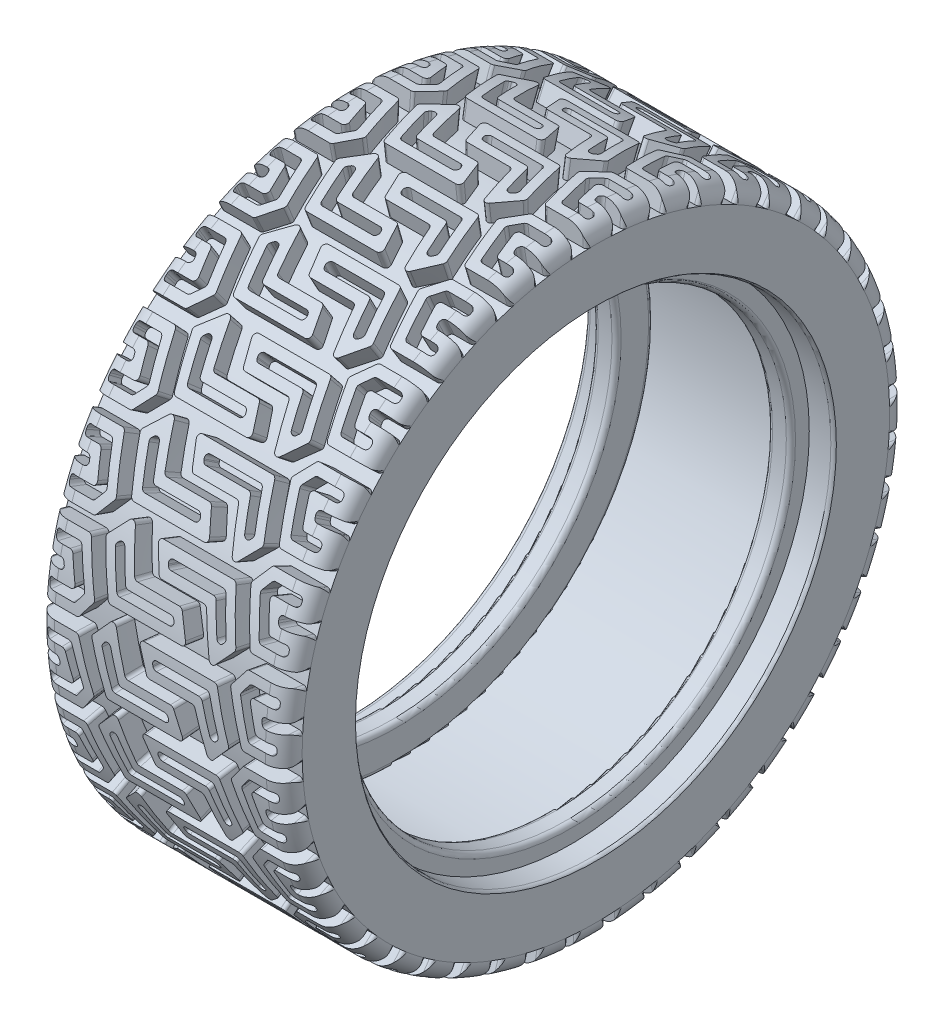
SolidWorks part; units mm, degrees
ref_plane "前视基准面" through (0, 0, 0) normal (0, 0, 1) x (1, 0, 0)
ref_plane "上视基准面" through (0, 0, 0) normal (0, 1, 0) x (1, 0, 0)
ref_plane "右视基准面" through (0, 0, 0) normal (1, 0, 0) x (0, 0, -1)
other "Configuration Table"
sketch "草图3" plane through (0, 0, 0) normal (0, 1, 0) x (1, 0, 0)
  line L0 (0, 0) -> (0, 32) construction
  line L1 (13.6, 32) -> (-13.6, 32)
  line L2 (-13.6, 32) -> (-13.6, 26.5)
  line L3 (-13.1, 26) -> (-10.75, 26)
  line L4 (-10.75, 26) -> (-10.75, 24.5)
  line L5 (-10.25, 24) -> (-8.75, 24)
  line L6 (10.75, 26) -> (10.75, 24.5)
  line L7 (13.1, 26) -> (10.75, 26)
  line L8 (13.6, 32) -> (13.6, 26.5)
  line L9 (-8.25, 24.5) -> (-8.25, 27.5)
  line L10 (-8.75, 28) -> (-11.1, 28)
  line L11 (-11.6, 28.5) -> (-11.6, 29.5)
  line L12 (-11.1, 30) -> (11.1, 30)
  line L13 (11.6, 28.5) -> (11.6, 29.5)
  line L14 (8.25, 24.5) -> (8.25, 27.5)
  line L15 (8.75, 28) -> (11.1, 28)
  line L16 (8.75, 24) -> (10.25, 24)
  line L17 (0, 0) -> (-29.1572, 0) construction
  arc A0 (13.1, 26) -> (13.6, 26.5) centre (13.1, 26.5) ccw
  arc A1 (10.75, 24.5) -> (10.25, 24) centre (10.25, 24.5) cw
  arc A2 (8.25, 24.5) -> (8.75, 24) centre (8.75, 24.5) ccw
  arc A3 (8.25, 27.5) -> (8.75, 28) centre (8.75, 27.5) cw
  arc A4 (11.6, 28.5) -> (11.1, 28) centre (11.1, 28.5) cw
  arc A5 (11.6, 29.5) -> (11.1, 30) centre (11.1, 29.5) ccw
  arc A6 (-11.6, 29.5) -> (-11.1, 30) centre (-11.1, 29.5) cw
  arc A7 (-11.1, 28) -> (-11.6, 28.5) centre (-11.1, 28.5) cw
  arc A8 (-8.25, 27.5) -> (-8.75, 28) centre (-8.75, 27.5) ccw
  arc A9 (-8.25, 24.5) -> (-8.75, 24) centre (-8.75, 24.5) cw
  arc A10 (-10.75, 24.5) -> (-10.25, 24) centre (-10.25, 24.5) ccw
  arc A11 (-13.6, 26.5) -> (-13.1, 26) centre (-13.1, 26.5) ccw
  point P9 (0, 24)
  point P21 (0, 30)
  point P24 (13.6, 26)
  point P27 (10.75, 24)
  point P30 (8.25, 24)
  point P33 (8.25, 28)
  point P36 (11.6, 28)
  point P39 (11.6, 30)
  point P42 (-11.6, 30)
  point P45 (-11.6, 28)
  point P48 (-8.25, 28)
  point P51 (-8.25, 24)
  point P54 (-10.75, 24)
  point P57 (-13.6, 26)
  dimension "D10" = 0.5
  dimension "D1" = 27.2
  dimension "D2" = 24
  dimension "D3" = 32
  dimension "D4" = 26
  dimension "D5" = 21.5
  dimension "D6" = 2
  dimension "D7" = 2.5
  dimension "D8" = 2
  dimension "D9" = 2
revolve "旋转1" add sketch "草图3" angle 360 about L17
sketch "草图4" plane through (0, 0, 0) normal (0, 0, 1) x (1, 0, 0)
  line L0 (0, 0) -> (-20.571, 0) construction
  line L1 (-3.75, -0.6) -> (1.4, -0.6)
  line L2 (1.4, -0.6) -> (2.5, -3.5)
  line L3 (2.5, -3.5) -> (-6, -3.5)
  line L4 (-6, -3.5) -> (-7.5, 1.5)
  line L5 (-7.5, 1.5) -> (-5.13, 4)
  line L6 (-5.13, 4) -> (-3.75, -0.6)
  line L7 (-8.916, 1) -> (-7.416, -4)
  line L8 (-7.416, -4) -> (-9, -6)
  line L9 (-9, -6) -> (-13.5, -6)
  line L11 (-13.5, -6) -> (-13.5, -3)
  line L12 (-13.5, -3) -> (-10.8481, -3)
  line L13 (-10.8481, -3) -> (-11.1481, -2)
  line L14 (-11.1481, -2) -> (-13.5, -2)
  line L15 (-13.5, -2) -> (-13.5, 1)
  line L16 (-13.5, 1) -> (-8.916, 1)
  line L17 (-9.6601, 0) -> (-8.5237, -3.7879)
  line L18 (-8.5237, -3.7879) -> (-9.4837, -5)
  line L19 (-9.4837, -5) -> (-12.5, -5)
  line L20 (-12.5, -5) -> (-12.5, -4)
  line L21 (-12.5, -4) -> (-9.5041, -4)
  line L22 (-9.5041, -4) -> (-10.4041, -1)
  line L23 (-10.4041, -1) -> (-12.5, -1)
  line L24 (-12.5, -1) -> (-12.5, 0)
  line L25 (-12.5, 0) -> (-9.6601, 0)
  line L26 (-4.494, -1.6) -> (0.7098, -1.6)
  line L27 (0.7098, -1.6) -> (1.0512, -2.5)
  line L28 (1.0512, -2.5) -> (-5.256, -2.5)
  line L29 (-5.256, -2.5) -> (-6.3757, 1.2324)
  line L30 (-6.3757, 1.2324) -> (-5.5918, 2.0593)
  line L31 (-5.5918, 2.0593) -> (-4.494, -1.6)
  line L32 (13.5, -1) -> (8.916, -1)
  line L33 (8.916, -1) -> (7.416, 4)
  line L34 (7.416, 4) -> (9, 6)
  line L35 (9, 6) -> (13.5, 6)
  line L36 (13.5, 6) -> (13.5, 3)
  line L37 (13.5, 3) -> (10.8481, 3)
  line L38 (10.8481, 3) -> (11.1481, 2)
  line L39 (11.1481, 2) -> (13.5, 2)
  line L40 (13.5, 2) -> (13.5, -1)
  line L41 (9.6601, 0) -> (8.5237, 3.7879)
  line L42 (8.5237, 3.7879) -> (9.4837, 5)
  line L43 (9.4837, 5) -> (12.5, 5)
  line L44 (12.5, 5) -> (12.5, 4)
  line L45 (12.5, 4) -> (9.5041, 4)
  line L46 (9.5041, 4) -> (10.4041, 1)
  line L47 (10.4041, 1) -> (12.5, 1)
  line L48 (12.5, 1) -> (12.5, 0)
  line L49 (12.5, 0) -> (9.6601, 0)
  line L50 (5.13, -4) -> (3.75, 0.6)
  line L51 (3.75, 0.6) -> (-1.4, 0.6)
  line L52 (-1.4, 0.6) -> (-2.5, 3.5)
  line L53 (-2.5, 3.5) -> (6, 3.5)
  line L54 (6, 3.5) -> (7.5, -1.5)
  line L55 (7.5, -1.5) -> (5.13, -4)
  line L56 (4.494, 1.6) -> (-0.7098, 1.6)
  line L57 (-0.7098, 1.6) -> (-1.0512, 2.5)
  line L58 (-1.0512, 2.5) -> (5.256, 2.5)
  line L59 (5.256, 2.5) -> (6.3757, -1.2324)
  line L60 (6.3757, -1.2324) -> (5.5918, -2.0593)
  line L61 (5.5918, -2.0593) -> (4.494, 1.6)
  line L62 (-13.6, 32) -> (-13.6, -32) construction
  point P35 (0, 0)
  point P36 (-8.0407, -3.7654)
  point P37 (0, 0)
  point P68 (0, 0)
  point P69 (-10.468, -4)
  point P70 (0, 0)
  point P71 (0, 0)
  point P72 (0, 0)
  dimension "D4" = 1.2
  dimension "D5" = 7
  dimension "D6" = 5
  dimension "D7" = 2.8
  dimension "D8" = 12
  dimension "D9" = 7.5
  dimension "D10" = 15
  dimension "D11" = 3
  dimension "D12" = 8
  dimension "D13" = 1.5
  dimension "D14" = 3
  dimension "D15" = 7
  dimension "D16" = 1
  dimension "D17" = 5
  dimension "D18" = 4.5
  dimension "D19" = 1
  dimension "D20" = 0.1
  dimension "D1" = 1
  dimension "D2" = 1
  dimension "D3" = 2
sketch "草图5" plane through (0, 0, 0) normal (0, 0, 1) x (1, 0, 0)
  line L6 (1.4, -0.6) -> (-3.75, -0.6)
  line L7 (2.5, -3.5) -> (1.4, -0.6)
  line L8 (-6, -3.5) -> (2.5, -3.5)
  line L9 (-7.5, 1.5) -> (-6, -3.5)
  line L10 (-5.13, 4) -> (-7.5, 1.5)
  line L11 (-3.75, -0.6) -> (-5.13, 4)
  line L12 (1.1239, -0.6) -> (-3.4524, -0.6)
  line L13 (2.2945, -2.9581) -> (1.4979, -0.8581)
  line L14 (-5.7024, -3.5) -> (1.9205, -3.5)
  line L15 (-7.4334, 1.278) -> (-6.0855, -3.2149)
  line L16 (-5.605, 3.4989) -> (-7.3406, 1.6682)
  line L17 (-3.8355, -0.3149) -> (-4.9316, 3.3387)
  line L18 (3.75, 0.6) -> (5.13, -4)
  line L19 (-1.4, 0.6) -> (3.75, 0.6)
  line L20 (-2.5, 3.5) -> (-1.4, 0.6)
  line L21 (-9.4837, -5) -> (-8.5237, -3.7879)
  line L22 (-12.5, -5) -> (-9.4837, -5)
  line L23 (-12.5, -4) -> (-12.5, -5)
  line L24 (-9.5041, -4) -> (-12.5, -4)
  line L25 (-10.4041, -1) -> (-9.5041, -4)
  line L26 (-12.5, -1) -> (-10.4041, -1)
  line L27 (-12.5, 0) -> (-12.5, -1)
  line L28 (-9.6601, 0) -> (-12.5, 0)
  line L29 (-8.5237, -3.7879) -> (-9.6601, 0)
  line L30 (-9.3635, -4.8483) -> (-8.6532, -3.9514)
  line L31 (-12.1, -5) -> (-9.6771, -5)
  line L32 (-12.5, -4.4) -> (-12.5, -4.6)
  line L33 (-10.0417, -4) -> (-12.1, -4)
  line L34 (-10.3186, -1.2851) -> (-9.6586, -3.4851)
  line L35 (-12.1, -1) -> (-10.7017, -1)
  line L36 (-12.5, -0.4) -> (-12.5, -0.6)
  line L37 (-9.9577, 0) -> (-12.1, 0)
  line L38 (-8.5836, -3.5881) -> (-9.5746, -0.2851)
  line L39 (-10.8481, -3) -> (-13.5, -3)
  line L40 (-11.1481, -2) -> (-10.8481, -3)
  line L41 (-13.5, -2) -> (-11.1481, -2)
  line L42 (-13.5, 1) -> (-13.5, -2)
  line L43 (-8.916, 1) -> (-13.5, 1)
  line L44 (-7.416, -4) -> (-8.916, 1)
  line L45 (-9, -6) -> (-7.416, -4)
  line L46 (-13.5, -6) -> (-9, -6)
  line L47 (-13.5, -3) -> (-13.5, -6)
  line L48 (-11.3858, -3) -> (-13.1, -3)
  line L49 (-11.0626, -2.2851) -> (-11.0026, -2.4851)
  line L50 (-13.1, -2) -> (-11.4458, -2)
  line L51 (-13.5, 0.6) -> (-13.5, -1.6)
  line L52 (-9.2137, 1) -> (-13.1, 1)
  line L53 (-7.476, -3.8002) -> (-8.8305, 0.7149)
  line L54 (-8.8799, -5.8483) -> (-7.5455, -4.1635)
  line L55 (-13.1, -6) -> (-9.1935, -6)
  line L56 (-13.5, -3.4) -> (-13.5, -5.6)
  line L57 (6, 3.5) -> (-2.5, 3.5)
  line L58 (7.5, -1.5) -> (6, 3.5)
  line L59 (5.13, -4) -> (7.5, -1.5)
  line L60 (3.8355, 0.3149) -> (4.9316, -3.3387)
  line L61 (-1.1239, 0.6) -> (3.4524, 0.6)
  line L62 (-2.2945, 2.9581) -> (-1.4979, 0.8581)
  line L63 (5.7024, 3.5) -> (-1.9205, 3.5)
  line L64 (7.4334, -1.278) -> (6.0855, 3.2149)
  line L65 (5.605, -3.4989) -> (7.3406, -1.6682)
  line L66 (-6.3757, 1.2324) -> (-5.256, -2.5)
  line L67 (-5.5918, 2.0593) -> (-6.3757, 1.2324)
  line L68 (-4.494, -1.6) -> (-5.5918, 2.0593)
  line L69 (0.7098, -1.6) -> (-4.494, -1.6)
  line L70 (1.0512, -2.5) -> (0.7098, -1.6)
  line L71 (-5.256, -2.5) -> (1.0512, -2.5)
  line L72 (-6.3091, 1.0105) -> (-5.3415, -2.2149)
  line L73 (-6.0668, 1.5582) -> (-6.2163, 1.4006)
  line L74 (-4.5795, -1.3149) -> (-5.3934, 1.398)
  line L75 (0.4337, -1.6) -> (-4.1964, -1.6)
  line L76 (0.8456, -1.9581) -> (0.8077, -1.8581)
  line L77 (-4.9584, -2.5) -> (0.4716, -2.5)
  line L78 (5.256, 2.5) -> (-1.0512, 2.5)
  line L79 (6.3757, -1.2324) -> (5.256, 2.5)
  line L80 (5.5918, -2.0593) -> (6.3757, -1.2324)
  line L81 (9.4837, 5) -> (8.5237, 3.7879)
  line L82 (12.5, 5) -> (9.4837, 5)
  line L83 (12.5, 4) -> (12.5, 5)
  line L84 (9.5041, 4) -> (12.5, 4)
  line L85 (10.4041, 1) -> (9.5041, 4)
  line L86 (12.5, 1) -> (10.4041, 1)
  line L87 (12.5, 0) -> (12.5, 1)
  line L88 (9.6601, 0) -> (12.5, 0)
  line L89 (8.5237, 3.7879) -> (9.6601, 0)
  line L90 (9.3635, 4.8483) -> (8.6532, 3.9514)
  line L91 (12.1, 5) -> (9.6771, 5)
  line L92 (12.5, 4.4) -> (12.5, 4.6)
  line L93 (10.0417, 4) -> (12.1, 4)
  line L94 (10.3186, 1.2851) -> (9.6586, 3.4851)
  line L95 (12.1, 1) -> (10.7017, 1)
  line L96 (12.5, 0.4) -> (12.5, 0.6)
  line L97 (9.9577, 0) -> (12.1, 0)
  line L98 (8.5836, 3.5881) -> (9.5746, 0.2851)
  line L99 (8.916, -1) -> (13.5, -1)
  line L100 (7.416, 4) -> (8.916, -1)
  line L101 (9, 6) -> (7.416, 4)
  line L102 (13.5, 6) -> (9, 6)
  line L103 (13.5, 3) -> (13.5, 6)
  line L104 (10.8481, 3) -> (13.5, 3)
  line L105 (11.1481, 2) -> (10.8481, 3)
  line L106 (13.5, 2) -> (11.1481, 2)
  line L107 (13.5, -1) -> (13.5, 2)
  line L108 (9.2137, -1) -> (13.1, -1)
  line L109 (7.476, 3.8002) -> (8.8305, -0.7149)
  line L110 (8.8799, 5.8483) -> (7.5455, 4.1635)
  line L111 (13.1, 6) -> (9.1935, 6)
  line L112 (13.5, 3.4) -> (13.5, 5.6)
  line L113 (11.3858, 3) -> (13.1, 3)
  line L114 (11.0626, 2.2851) -> (11.0026, 2.4851)
  line L115 (13.1, 2) -> (11.4458, 2)
  line L116 (13.5, -0.6) -> (13.5, 1.6)
  line L117 (4.494, 1.6) -> (5.5918, -2.0593)
  line L118 (-0.7098, 1.6) -> (4.494, 1.6)
  line L119 (-1.0512, 2.5) -> (-0.7098, 1.6)
  line L120 (4.9584, 2.5) -> (-0.4716, 2.5)
  line L121 (6.3091, -1.0105) -> (5.3415, 2.2149)
  line L122 (6.0668, -1.5582) -> (6.2163, -1.4006)
  line L123 (4.5795, 1.3149) -> (5.3934, -1.398)
  line L124 (-0.4337, 1.6) -> (4.1964, 1.6)
  line L125 (-0.8456, 1.9581) -> (-0.8077, 1.8581)
  arc A0 (-0.4337, 1.6) -> (-0.8077, 1.8581) centre (-0.4337, 2) cw
  arc A1 (4.5795, 1.3149) -> (4.1964, 1.6) centre (4.1964, 1.2) ccw
  arc A2 (13.1, 2) -> (13.5, 1.6) centre (13.1, 1.6) cw
  arc A3 (11.0626, 2.2851) -> (11.4458, 2) centre (11.4458, 2.4) ccw
  arc A4 (6.0668, -1.5582) -> (5.3934, -1.398) centre (5.7766, -1.2831) cw
  arc A5 (11.3858, 3) -> (11.0026, 2.4851) centre (11.3858, 2.6) ccw
  arc A6 (13.5, 3.4) -> (13.1, 3) centre (13.1, 3.4) cw
  arc A7 (6.3091, -1.0105) -> (6.2163, -1.4006) centre (5.926, -1.1254) cw
  arc A8 (13.1, 6) -> (13.5, 5.6) centre (13.1, 5.6) cw
  arc A9 (9.9577, 0) -> (9.5746, 0.2851) centre (9.9577, 0.4) cw
  arc A10 (12.5, 0.4) -> (12.1, 0) centre (12.1, 0.4) cw
  arc A11 (8.8799, 5.8483) -> (9.1935, 6) centre (9.1935, 5.6) cw
  arc A12 (12.1, 1) -> (12.5, 0.6) centre (12.1, 0.6) cw
  arc A13 (4.9584, 2.5) -> (5.3415, 2.2149) centre (4.9584, 2.1) cw
  arc A14 (10.3186, 1.2851) -> (10.7017, 1) centre (10.7017, 1.4) ccw
  arc A15 (7.476, 3.8002) -> (7.5455, 4.1635) centre (7.8591, 3.9152) cw
  arc A16 (10.0417, 4) -> (9.6586, 3.4851) centre (10.0417, 3.6) ccw
  arc A17 (-0.4716, 2.5) -> (-0.8456, 1.9581) centre (-0.4716, 2.1) ccw
  arc A18 (12.5, 4.4) -> (12.1, 4) centre (12.1, 4.4) cw
  arc A19 (9.2137, -1) -> (8.8305, -0.7149) centre (9.2137, -0.6) cw
  arc A20 (0.8456, -1.9581) -> (0.4716, -2.5) centre (0.4716, -2.1) cw
  arc A21 (12.1, 5) -> (12.5, 4.6) centre (12.1, 4.6) cw
  arc A22 (0.4337, -1.6) -> (0.8077, -1.8581) centre (0.4337, -2) cw
  arc A23 (13.1, -1) -> (13.5, -0.6) centre (13.1, -0.6) ccw
  arc A24 (-4.5795, -1.3149) -> (-4.1964, -1.6) centre (-4.1964, -1.2) ccw
  arc A25 (9.3635, 4.8483) -> (9.6771, 5) centre (9.6771, 4.6) cw
  arc A26 (7.4334, -1.278) -> (7.3406, -1.6682) centre (7.0503, -1.393) cw
  arc A27 (-6.0668, 1.5582) -> (-5.3934, 1.398) centre (-5.7766, 1.2831) cw
  arc A28 (5.7024, 3.5) -> (6.0855, 3.2149) centre (5.7024, 3.1) cw
  arc A29 (-13.1, -6) -> (-13.5, -5.6) centre (-13.1, -5.6) cw
  arc A30 (8.6532, 3.9514) -> (8.5836, 3.5881) centre (8.9668, 3.7031) ccw
  arc A31 (-8.8799, -5.8483) -> (-9.1935, -6) centre (-9.1935, -5.6) cw
  arc A32 (-2.2945, 2.9581) -> (-1.9205, 3.5) centre (-1.9205, 3.1) cw
  arc A33 (-7.476, -3.8002) -> (-7.5455, -4.1635) centre (-7.8591, -3.9152) cw
  arc A34 (-6.3091, 1.0105) -> (-6.2163, 1.4006) centre (-5.926, 1.1254) cw
  arc A35 (-9.2137, 1) -> (-8.8305, 0.7149) centre (-9.2137, 0.6) cw
  arc A36 (-1.1239, 0.6) -> (-1.4979, 0.8581) centre (-1.1239, 1) cw
  arc A37 (-13.5, 0.6) -> (-13.1, 1) centre (-13.1, 0.6) cw
  arc A38 (-9.9577, 0) -> (-9.5746, -0.2851) centre (-9.9577, -0.4) cw
  arc A39 (-5.3415, -2.2149) -> (-4.9584, -2.5) centre (-4.9584, -2.1) ccw
  arc A40 (-12.5, -0.4) -> (-12.1, 0) centre (-12.1, -0.4) cw
  arc A41 (-13.1, -2) -> (-13.5, -1.6) centre (-13.1, -1.6) cw
  arc A42 (-12.1, -1) -> (-12.5, -0.6) centre (-12.1, -0.6) cw
  arc A43 (3.8355, 0.3149) -> (3.4524, 0.6) centre (3.4524, 0.2) ccw
  arc A44 (-10.3186, -1.2851) -> (-10.7017, -1) centre (-10.7017, -1.4) ccw
  arc A45 (-11.0626, -2.2851) -> (-11.4458, -2) centre (-11.4458, -2.4) ccw
  arc A46 (-10.0417, -4) -> (-9.6586, -3.4851) centre (-10.0417, -3.6) ccw
  arc A47 (4.9316, -3.3387) -> (5.605, -3.4989) centre (5.3147, -3.2237) ccw
  arc A48 (-12.5, -4.4) -> (-12.1, -4) centre (-12.1, -4.4) cw
  arc A49 (-11.3858, -3) -> (-11.0026, -2.4851) centre (-11.3858, -2.6) ccw
  arc A50 (-5.605, 3.4989) -> (-4.9316, 3.3387) centre (-5.3147, 3.2237) cw
  arc A51 (-12.1, -5) -> (-12.5, -4.6) centre (-12.1, -4.6) cw
  arc A52 (-7.4334, 1.278) -> (-7.3406, 1.6682) centre (-7.0503, 1.393) cw
  arc A53 (-13.1, -3) -> (-13.5, -3.4) centre (-13.1, -3.4) ccw
  arc A54 (-5.7024, -3.5) -> (-6.0855, -3.2149) centre (-5.7024, -3.1) cw
  arc A55 (-9.3635, -4.8483) -> (-9.6771, -5) centre (-9.6771, -4.6) cw
  arc A56 (2.2945, -2.9581) -> (1.9205, -3.5) centre (1.9205, -3.1) cw
  arc A57 (-8.6532, -3.9514) -> (-8.5836, -3.5881) centre (-8.9668, -3.7031) ccw
  arc A58 (1.1239, -0.6) -> (1.4979, -0.8581) centre (1.1239, -1) cw
  arc A59 (-3.4524, -0.6) -> (-3.8355, -0.3149) centre (-3.4524, -0.2) cw
  dimension "D9" = 0.4
  dimension "D1" = 0
  dimension "D2" = 0
  dimension "D3" = 0
  dimension "D4" = 0
  dimension "D5" = 0
  dimension "D6" = 0
  dimension "D7" = 0
  dimension "D8" = 0
wrap "包覆1" sketch "草图5" wrap type emboss source sketch "草图5" thickness 2 parameters "D1"=2
pattern_circular "阵列(圆周)1" count 24 over 360 about axis through (0, 0, 0) along (1, 0, 0) of "包覆1"
sketch "草图6" plane through (0, 0, 0) normal (0, 1, 0) x (1, 0, 0)
  line L0 (-13.5, 32) -> (-13.5, 34) construction
  line L1 (-13.5, 34) -> (-11.5, 34)
  line L2 (-26.422, 0) -> (0, 0) construction
  line L3 (0, 0) -> (0, 47.4685) construction
  line L7 (-13.5, 32) -> (-13.5, 23.6491)
  line L8 (-13.5, 24.4882) -> (-13.5, 22.81) construction
  line L9 (-13.5, 23.6491) -> (-14.5, 23.6491)
  line L10 (-14.5, 23.6491) -> (-14.5, 34)
  line L11 (-14.5, 34) -> (-13.5, 34)
  line L12 (-13.5, 33.0007) -> (-13.5, 32.3606) construction
  line L13 (13.5, 32) -> (13.5, 34) construction
  line L14 (14.5, 34) -> (13.5, 34)
  line L15 (14.5, 23.6491) -> (14.5, 34)
  line L16 (13.5, 23.6491) -> (14.5, 23.6491)
  line L17 (13.5, 32) -> (13.5, 23.6491)
  line L18 (13.5, 34) -> (11.5, 34)
  arc A0 (-11.5, 34) -> (-13.5, 32) centre (-11.5, 32) ccw
  arc A2 (11.5, 34) -> (13.5, 32) centre (11.5, 32) cw
  point P7 (-13.5, 32.5)
  dimension "D1" = 34
  dimension "D2" = 2
  dimension "D3" = 1
revolve "切除-旋转1" cut sketch "草图6" angle 360 about L2
